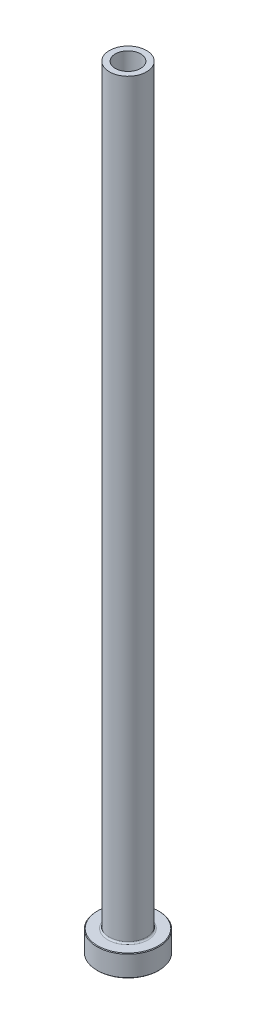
SolidWorks part; units mm, degrees
ref_plane "Front Plane" through (0, 0, 0) normal (0, 0, 1) x (1, 0, 0)
ref_plane "Top Plane" through (0, 0, 0) normal (0, 1, 0) x (1, 0, 0)
ref_plane "Right Plane" through (0, 0, 0) normal (1, 0, 0) x (0, 0, -1)
sketch "Sketch1" plane through (0, 0, 0) normal (0, 0, 1) x (1, 0, 0)
  line L0 (-4.1, 250) -> (-6, 250)
  line L1 (-6, 250) -> (-6, 7)
  line L2 (-6, 7) -> (-10, 7)
  line L3 (-10, 7) -> (-10, 0)
  line L4 (11, 0) -> (-11, 0) construction
  line L5 (-10, 0) -> (-4.35, 0)
  line L6 (-4.1, 205) -> (-4.1, 250)
  line L7 (0, 92.1877) -> (0, -15.5353) construction
  line L8 (0, -11) -> (0, 11) construction
  line L9 (-4.1, 205) -> (-4.35, 193)
  line L10 (-4.35, 193) -> (-4.35, 0)
  dimension "D1" = 0.25
  dimension "ID" = 8.2
  dimension "OD" = 12
  dimension "L" = 250
  dimension "H" = 20
  dimension "T" = 7
  dimension "N" = 45
  dimension "D2" = 12
revolve "Revolve1" add sketch "Sketch1" angle 360 about L7
fillet "Fillet1" radius 0.5 1 edges at (0, 7, 6)
chamfer "Chamfer1" distance 0.2 angle 45 2 edges at (0, 7, 10) (0, 0, 10)
chamfer "Chamfer3" distance 0.5 angle 45 1 edges at (0, 0, 4.35)
